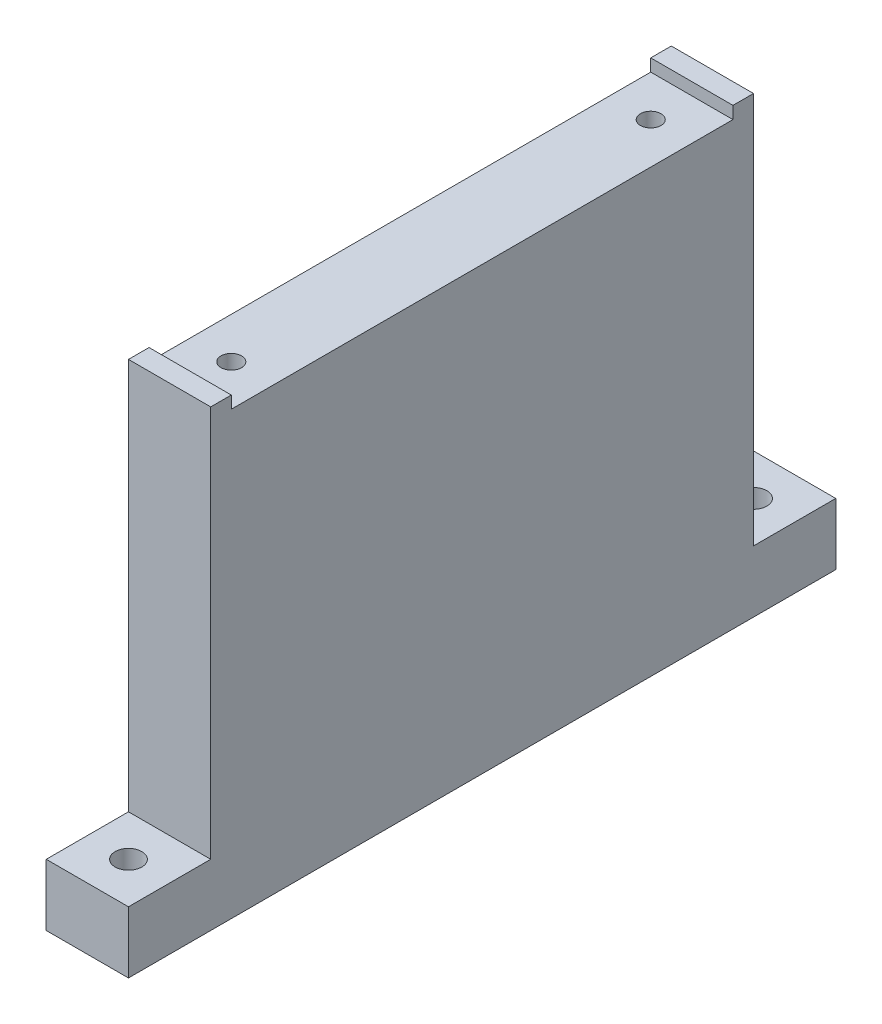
SolidWorks part; units mm, degrees
ref_plane "前视基准面" through (0, 0, 0) normal (0, 0, 1) x (1, 0, 0)
ref_plane "上视基准面" through (0, 0, 0) normal (0, 1, 0) x (1, 0, 0)
ref_plane "右视基准面" through (0, 0, 0) normal (1, 0, 0) x (0, 0, -1)
sketch "草图1" plane through (0, 0, 0) normal (0, 0, 1) x (1, 0, 0)
  line L0 (20, 0) -> (20, 110.28)
  line L1 (0, 0) -> (0, 110.28)
  line L2 (0, 110.28) -> (20, 110.28)
  line L3 (0, 0) -> (20, 0)
extrude "凸台-拉伸1" add sketch "草图1" along normal blind 172
sketch "草图2" plane through (20, 0, 0) normal (1, 0, 0) x (0, 0, -1)
  line L0 (-25, 107.28) -> (-25, 110.28)
  line L1 (-147, 107.28) -> (-147, 110.28)
  line L2 (-147, 107.28) -> (-25, 107.28)
  line L3 (-152, 110.28) -> (-147, 110.28)
  line L4 (-20, 15) -> (-20, 110.28)
  line L5 (-152, 15) -> (-152, 110.28)
  line L6 (-172, 0) -> (0, 0)
  line L7 (0, 0) -> (0, 15)
  line L8 (-172, 0) -> (-172, 15)
  line L9 (-172, 15) -> (-152, 15)
  line L10 (-25, 110.28) -> (-20, 110.28)
  line L11 (-20, 15) -> (0, 15)
extrude "切除-拉伸1" cut sketch "草图2" against normal blind 172 flip side to cut
sketch "草图3" plane through (0, 15, 0) normal (0, 1, 0) x (1, 0, 0)
  circle A0 centre (10, -10) radius 3.25
  circle A1 centre (10, -162) radius 3.25
extrude "切除-拉伸2" cut sketch "草图3" against normal blind 172
sketch "草图4" plane through (0, 107.28, 0) normal (0, 1, 0) x (1, 0, 0)
  circle A0 centre (10, -35) radius 2.5
  circle A1 centre (10, -137) radius 2.5
extrude "切除-拉伸3" cut sketch "草图4" against normal blind 25
